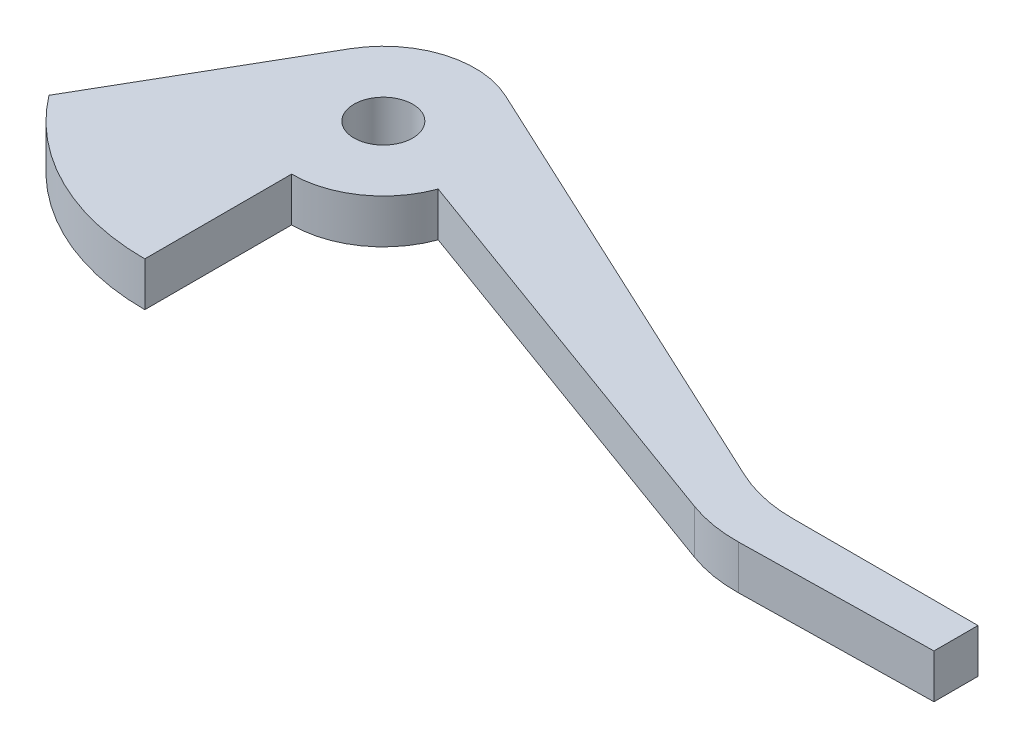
SolidWorks part; units mm, degrees
ref_plane "Plan de face" through (0, 0, 0) normal (0, 0, 1) x (1, 0, 0)
ref_plane "Plan de dessus" through (0, 0, 0) normal (0, 1, 0) x (1, 0, 0)
ref_plane "Plan de droite" through (0, 0, 0) normal (1, 0, 0) x (0, 0, -1)
sketch "Esquisse1" plane through (0, 11.2301, 0) normal (0, 1, 0) x (1, 0, 0)
  line L0 (3.8218, -64.1124) -> (3.8218, -74.1124)
  line L1 (6.4631, -52.198) -> (38.9834, -67.3624)
  line L2 (38.9834, -67.3624) -> (53.8218, -67.3624)
  line L4 (53.8218, -67.3624) -> (53.8218, -70.3624)
  line L5 (53.8218, -70.3624) -> (38.8877, -70.6254)
  line L6 (38.8877, -70.6254) -> (9.6949, -60.0001)
  line L7 (-1.5909, -54.7374) -> (-9.0909, -67.7278)
  arc A0 (3.8218, -64.1124) -> (9.6949, -60.0001) centre (3.8218, -57.8624) ccw
  arc A1 (-9.0909, -67.7278) -> (3.8218, -74.1124) centre (3.8218, -57.8624) ccw
  arc A3 (6.4631, -52.198) -> (-1.5909, -54.7374) centre (3.8218, -57.8624) ccw
  circle A4 centre (3.8218, -57.8624) radius 2 construction
  circle A5 centre (3.8218, -57.8624) radius 2
  dimension "D1" = 12.5
  dimension "D2" = 32.5
  dimension "D3" = 3
  dimension "D4" = 30
  dimension "D5" = 9.5
  dimension "D6" = 65
  dimension "D7" = 70
  dimension "D8" = 50
extrude "Boss.-Extru.1" add sketch "Esquisse1" along normal blind 3
fillet "Congé1" radius 10 2 edges at (38.8877, 12.7301, 70.6254) (38.9834, 12.7301, 67.3624)
